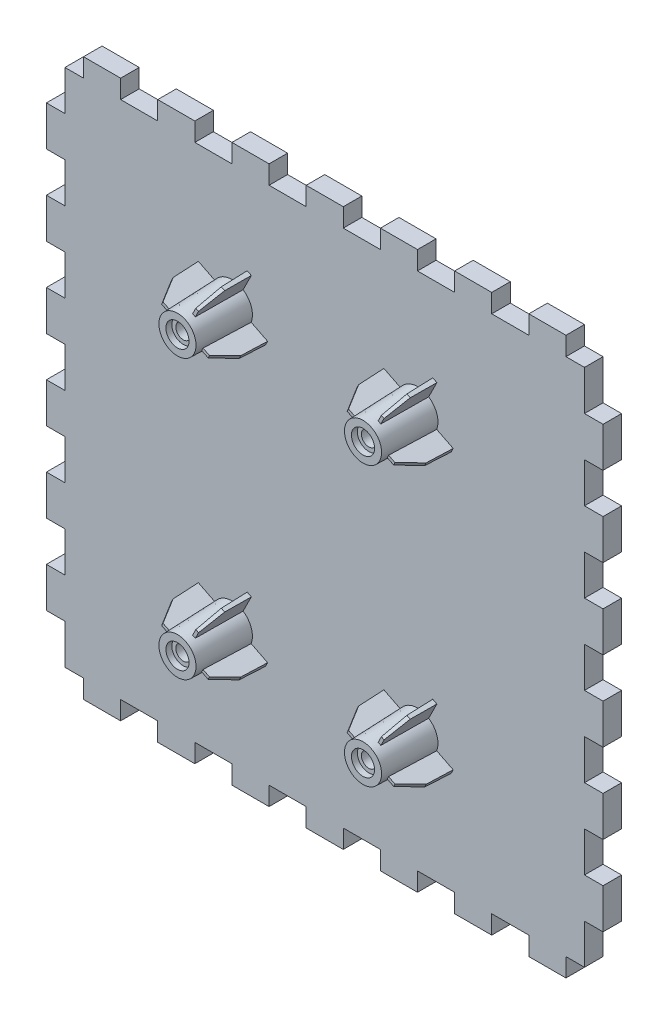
SolidWorks part; units mm, degrees
ref_plane "Front Plane" through (0, 0, 0) normal (0, 0, 1) x (1, 0, 0)
ref_plane "Top Plane" through (0, 0, 0) normal (0, 1, 0) x (1, 0, 0)
ref_plane "Right Plane" through (0, 0, 0) normal (1, 0, 0) x (0, 0, -1)
sketch "Model" plane through (0, 0, 0) normal (0, 0, 1) x (1, 0, 0)
  line L0 (83, 83) -> (87, 83)
  line L1 (87, 83) -> (87, 79)
  line L2 (87, 79) -> (95, 79)
  line L3 (95, 79) -> (95, 83)
  line L4 (95, 83) -> (103, 83)
  line L5 (103, 83) -> (103, 79)
  line L6 (103, 79) -> (111, 79)
  line L7 (111, 79) -> (111, 83)
  line L8 (111, 83) -> (119, 83)
  line L9 (119, 83) -> (119, 79)
  line L10 (119, 79) -> (127, 79)
  line L11 (127, 79) -> (127, 83)
  line L12 (127, 83) -> (135, 83)
  line L13 (135, 83) -> (135, 79)
  line L14 (135, 79) -> (143, 79)
  line L15 (143, 79) -> (143, 83)
  line L16 (143, 83) -> (151, 83)
  line L17 (151, 83) -> (151, 79)
  line L18 (151, 79) -> (159, 79)
  line L19 (159, 79) -> (159, 83)
  line L20 (159, 83) -> (167, 83)
  line L21 (167, 83) -> (167, 79)
  line L22 (167, 79) -> (175, 79)
  line L23 (175, 79) -> (175, 83)
  line L24 (175, 83) -> (183, 83)
  line L25 (183, 83) -> (183, 79)
  line L26 (183, 79) -> (191, 79)
  line L27 (191, 79) -> (191, 83)
  line L28 (191, 83) -> (195, 83)
  line L29 (195, 83) -> (195, 91.61)
  line L30 (195, 91.61) -> (199, 91.61)
  line L31 (199, 91.61) -> (199, 100.23)
  line L32 (199, 100.23) -> (195, 100.23)
  line L33 (195, 100.23) -> (195, 108.85)
  line L34 (195, 108.85) -> (199, 108.85)
  line L35 (199, 108.85) -> (199, 117.46)
  line L36 (199, 117.46) -> (195, 117.46)
  line L37 (195, 117.46) -> (195, 126.08)
  line L38 (195, 126.08) -> (199, 126.08)
  line L39 (199, 126.08) -> (199, 134.69)
  line L40 (199, 134.69) -> (195, 134.69)
  line L41 (195, 134.69) -> (195, 143.31)
  line L42 (195, 143.31) -> (199, 143.31)
  line L43 (199, 143.31) -> (199, 151.92)
  line L44 (199, 151.92) -> (195, 151.92)
  line L45 (195, 151.92) -> (195, 160.54)
  line L46 (195, 160.54) -> (199, 160.54)
  line L47 (199, 160.54) -> (199, 169.15)
  line L48 (199, 169.15) -> (195, 169.15)
  line L49 (195, 169.15) -> (195, 177.77)
  line L50 (195, 177.77) -> (199, 177.77)
  line L51 (199, 177.77) -> (199, 186.38)
  line L52 (199, 186.38) -> (195, 186.38)
  line L53 (195, 186.38) -> (195, 195)
  line L54 (195, 195) -> (191, 195)
  line L55 (191, 195) -> (191, 199)
  line L56 (191, 199) -> (183, 199)
  line L57 (183, 199) -> (183, 195)
  line L58 (183, 195) -> (175, 195)
  line L59 (175, 195) -> (175, 199)
  line L60 (175, 199) -> (167, 199)
  line L61 (167, 199) -> (167, 195)
  line L62 (167, 195) -> (159, 195)
  line L63 (159, 195) -> (159, 199)
  line L64 (159, 199) -> (151, 199)
  line L65 (151, 199) -> (151, 195)
  line L66 (151, 195) -> (143, 195)
  line L67 (143, 195) -> (143, 199)
  line L68 (143, 199) -> (135, 199)
  line L69 (135, 199) -> (135, 195)
  line L70 (135, 195) -> (127, 195)
  line L71 (127, 195) -> (127, 199)
  line L72 (127, 199) -> (119, 199)
  line L73 (119, 199) -> (119, 195)
  line L74 (119, 195) -> (111, 195)
  line L75 (111, 195) -> (111, 199)
  line L76 (111, 199) -> (103, 199)
  line L77 (103, 199) -> (103, 195)
  line L78 (103, 195) -> (95, 195)
  line L79 (95, 195) -> (95, 199)
  line L80 (95, 199) -> (87, 199)
  line L81 (87, 199) -> (87, 195)
  line L82 (87, 195) -> (83, 195)
  line L83 (83, 195) -> (83, 186.38)
  line L84 (83, 186.38) -> (79, 186.38)
  line L85 (79, 186.38) -> (79, 177.77)
  line L86 (79, 177.77) -> (83, 177.77)
  line L87 (83, 177.77) -> (83, 169.15)
  line L88 (83, 169.15) -> (79, 169.15)
  line L89 (79, 169.15) -> (79, 160.54)
  line L90 (79, 160.54) -> (83, 160.54)
  line L91 (83, 160.54) -> (83, 151.92)
  line L92 (83, 151.92) -> (79, 151.92)
  line L93 (79, 151.92) -> (79, 143.31)
  line L94 (79, 143.31) -> (83, 143.31)
  line L95 (83, 143.31) -> (83, 134.69)
  line L96 (83, 134.69) -> (79, 134.69)
  line L97 (79, 134.69) -> (79, 126.08)
  line L98 (79, 126.08) -> (83, 126.08)
  line L99 (83, 126.08) -> (83, 117.46)
  line L100 (83, 117.46) -> (79, 117.46)
  line L101 (79, 117.46) -> (79, 108.85)
  line L102 (79, 108.85) -> (83, 108.85)
  line L103 (83, 108.85) -> (83, 100.23)
  line L104 (83, 100.23) -> (79, 100.23)
  line L105 (79, 100.23) -> (79, 91.61)
  line L106 (79, 91.61) -> (83, 91.61)
  line L107 (83, 91.61) -> (83, 83)
  line L108 (83, 0) -> (91.61, 0)
  line L109 (91.61, 0) -> (91.61, 4)
  line L110 (91.61, 4) -> (100.23, 4)
  line L111 (100.23, 4) -> (100.23, 0)
  line L112 (100.23, 0) -> (108.85, 0)
  line L113 (108.85, 0) -> (108.85, 4)
  line L114 (108.85, 4) -> (117.46, 4)
  line L115 (117.46, 4) -> (117.46, 0)
  line L116 (117.46, 0) -> (126.08, 0)
  line L117 (126.08, 0) -> (126.08, 4)
  line L118 (126.08, 4) -> (134.69, 4)
  line L119 (134.69, 4) -> (134.69, 0)
  line L120 (134.69, 0) -> (143.31, 0)
  line L121 (143.31, 0) -> (143.31, 4)
  line L122 (143.31, 4) -> (151.92, 4)
  line L123 (151.92, 4) -> (151.92, 0)
  line L124 (151.92, 0) -> (160.54, 0)
  line L125 (160.54, 0) -> (160.54, 4)
  line L126 (160.54, 4) -> (169.15, 4)
  line L127 (169.15, 4) -> (169.15, 0)
  line L128 (169.15, 0) -> (177.77, 0)
  line L129 (177.77, 0) -> (177.77, 4)
  line L130 (177.77, 4) -> (186.38, 4)
  line L131 (186.38, 4) -> (186.38, 0)
  line L132 (186.38, 0) -> (195, 0)
  line L133 (195, 0) -> (199, 0)
  line L134 (199, 0) -> (199, 8.33)
  line L135 (199, 8.33) -> (195, 8.33)
  line L136 (195, 8.33) -> (195, 16.67)
  line L137 (195, 16.67) -> (199, 16.67)
  line L138 (199, 16.67) -> (199, 25)
  line L139 (199, 25) -> (195, 25)
  line L140 (195, 25) -> (195, 33.33)
  line L141 (195, 33.33) -> (199, 33.33)
  line L142 (199, 33.33) -> (199, 41.67)
  line L143 (199, 41.67) -> (195, 41.67)
  line L144 (195, 41.67) -> (195, 50)
  line L145 (195, 50) -> (199, 50)
  line L146 (199, 50) -> (199, 58.33)
  line L147 (199, 58.33) -> (195, 58.33)
  line L148 (195, 58.33) -> (195, 66.67)
  line L149 (195, 66.67) -> (199, 66.67)
  line L150 (199, 66.67) -> (199, 75)
  line L151 (199, 75) -> (191, 75)
  line L152 (191, 75) -> (191, 71)
  line L153 (191, 71) -> (183, 71)
  line L154 (183, 71) -> (183, 75)
  line L155 (183, 75) -> (175, 75)
  line L156 (175, 75) -> (175, 71)
  line L157 (175, 71) -> (167, 71)
  line L158 (167, 71) -> (167, 75)
  line L159 (167, 75) -> (159, 75)
  line L160 (159, 75) -> (159, 71)
  line L161 (159, 71) -> (151, 71)
  line L162 (151, 71) -> (151, 75)
  line L163 (151, 75) -> (143, 75)
  line L164 (143, 75) -> (143, 71)
  line L165 (143, 71) -> (135, 71)
  line L166 (135, 71) -> (135, 75)
  line L167 (135, 75) -> (127, 75)
  line L168 (127, 75) -> (127, 71)
  line L169 (127, 71) -> (119, 71)
  line L170 (119, 71) -> (119, 75)
  line L171 (119, 75) -> (111, 75)
  line L172 (111, 75) -> (111, 71)
  line L173 (111, 71) -> (103, 71)
  line L174 (103, 71) -> (103, 75)
  line L175 (103, 75) -> (95, 75)
  line L176 (95, 75) -> (95, 71)
  line L177 (95, 71) -> (87, 71)
  line L178 (87, 71) -> (87, 75)
  line L179 (87, 75) -> (79, 75)
  line L180 (79, 75) -> (79, 66.67)
  line L181 (79, 66.67) -> (83, 66.67)
  line L182 (83, 66.67) -> (83, 58.33)
  line L183 (83, 58.33) -> (79, 58.33)
  line L184 (79, 58.33) -> (79, 50)
  line L185 (79, 50) -> (83, 50)
  line L186 (83, 50) -> (83, 41.67)
  line L187 (83, 41.67) -> (79, 41.67)
  line L188 (79, 41.67) -> (79, 33.33)
  line L189 (79, 33.33) -> (83, 33.33)
  line L190 (83, 33.33) -> (83, 25)
  line L191 (83, 25) -> (79, 25)
  line L192 (79, 25) -> (79, 16.67)
  line L193 (79, 16.67) -> (83, 16.67)
  line L194 (83, 16.67) -> (83, 8.33)
  line L195 (83, 8.33) -> (79, 8.33)
  line L196 (79, 8.33) -> (79, 0)
  line L197 (79, 0) -> (83, 0)
  line L198 (83, 278) -> (91.61, 278)
  line L199 (91.61, 278) -> (91.61, 274)
  line L200 (91.61, 274) -> (100.23, 274)
  line L201 (100.23, 274) -> (100.23, 278)
  line L202 (100.23, 278) -> (108.85, 278)
  line L203 (108.85, 278) -> (108.85, 274)
  line L204 (108.85, 274) -> (117.46, 274)
  line L205 (117.46, 274) -> (117.46, 278)
  line L206 (117.46, 278) -> (126.08, 278)
  line L207 (126.08, 278) -> (126.08, 274)
  line L208 (126.08, 274) -> (134.69, 274)
  line L209 (134.69, 274) -> (134.69, 278)
  line L210 (134.69, 278) -> (143.31, 278)
  line L211 (143.31, 278) -> (143.31, 274)
  line L212 (143.31, 274) -> (151.92, 274)
  line L213 (151.92, 274) -> (151.92, 278)
  line L214 (151.92, 278) -> (160.54, 278)
  line L215 (160.54, 278) -> (160.54, 274)
  line L216 (160.54, 274) -> (169.15, 274)
  line L217 (169.15, 274) -> (169.15, 278)
  line L218 (169.15, 278) -> (177.77, 278)
  line L219 (177.77, 278) -> (177.77, 274)
  line L220 (177.77, 274) -> (186.38, 274)
  line L221 (186.38, 274) -> (186.38, 278)
  line L222 (186.38, 278) -> (195, 278)
  line L223 (195, 278) -> (199, 278)
  line L224 (199, 278) -> (199, 269.67)
  line L225 (199, 269.67) -> (195, 269.67)
  line L226 (195, 269.67) -> (195, 261.33)
  line L227 (195, 261.33) -> (199, 261.33)
  line L228 (199, 261.33) -> (199, 253)
  line L229 (199, 253) -> (195, 253)
  line L230 (195, 253) -> (195, 244.67)
  line L231 (195, 244.67) -> (199, 244.67)
  line L232 (199, 244.67) -> (199, 236.33)
  line L233 (199, 236.33) -> (195, 236.33)
  line L234 (195, 236.33) -> (195, 228)
  line L235 (195, 228) -> (199, 228)
  line L236 (199, 228) -> (199, 219.67)
  line L237 (199, 219.67) -> (195, 219.67)
  line L238 (195, 219.67) -> (195, 211.33)
  line L239 (195, 211.33) -> (199, 211.33)
  line L240 (199, 211.33) -> (199, 203)
  line L241 (199, 203) -> (191, 203)
  line L242 (191, 203) -> (191, 207)
  line L243 (191, 207) -> (183, 207)
  line L244 (183, 207) -> (183, 203)
  line L245 (183, 203) -> (175, 203)
  line L246 (175, 203) -> (175, 207)
  line L247 (175, 207) -> (167, 207)
  line L248 (167, 207) -> (167, 203)
  line L249 (167, 203) -> (159, 203)
  line L250 (159, 203) -> (159, 207)
  line L251 (159, 207) -> (151, 207)
  line L252 (151, 207) -> (151, 203)
  line L253 (151, 203) -> (143, 203)
  line L254 (143, 203) -> (143, 207)
  line L255 (143, 207) -> (135, 207)
  line L256 (135, 207) -> (135, 203)
  line L257 (135, 203) -> (127, 203)
  line L258 (127, 203) -> (127, 207)
  line L259 (127, 207) -> (119, 207)
  line L260 (119, 207) -> (119, 203)
  line L261 (119, 203) -> (111, 203)
  line L262 (111, 203) -> (111, 207)
  line L263 (111, 207) -> (103, 207)
  line L264 (103, 207) -> (103, 203)
  line L265 (103, 203) -> (95, 203)
  line L266 (95, 203) -> (95, 207)
  line L267 (95, 207) -> (87, 207)
  line L268 (87, 207) -> (87, 203)
  line L269 (87, 203) -> (79, 203)
  line L270 (79, 203) -> (79, 211.33)
  line L271 (79, 211.33) -> (83, 211.33)
  line L272 (83, 211.33) -> (83, 219.67)
  line L273 (83, 219.67) -> (79, 219.67)
  line L274 (79, 219.67) -> (79, 228)
  line L275 (79, 228) -> (83, 228)
  line L276 (83, 228) -> (83, 236.33)
  line L277 (83, 236.33) -> (79, 236.33)
  line L278 (79, 236.33) -> (79, 244.67)
  line L279 (79, 244.67) -> (83, 244.67)
  line L280 (83, 244.67) -> (83, 253)
  line L281 (83, 253) -> (79, 253)
  line L282 (79, 253) -> (79, 261.33)
  line L283 (79, 261.33) -> (83, 261.33)
  line L284 (83, 261.33) -> (83, 269.67)
  line L285 (83, 269.67) -> (79, 269.67)
  line L286 (79, 269.67) -> (79, 278)
  line L287 (79, 278) -> (83, 278)
  line L288 (0, 83) -> (0, 91.61)
  line L289 (0, 91.61) -> (4, 91.61)
  line L290 (4, 91.61) -> (4, 100.23)
  line L291 (4, 100.23) -> (0, 100.23)
  line L292 (0, 100.23) -> (0, 108.85)
  line L293 (0, 108.85) -> (4, 108.85)
  line L294 (4, 108.85) -> (4, 117.46)
  line L295 (4, 117.46) -> (0, 117.46)
  line L296 (0, 117.46) -> (0, 126.08)
  line L297 (0, 126.08) -> (4, 126.08)
  line L298 (4, 126.08) -> (4, 134.69)
  line L299 (4, 134.69) -> (0, 134.69)
  line L300 (0, 134.69) -> (0, 143.31)
  line L301 (0, 143.31) -> (4, 143.31)
  line L302 (4, 143.31) -> (4, 151.92)
  line L303 (4, 151.92) -> (0, 151.92)
  line L304 (0, 151.92) -> (0, 160.54)
  line L305 (0, 160.54) -> (4, 160.54)
  line L306 (4, 160.54) -> (4, 169.15)
  line L307 (4, 169.15) -> (0, 169.15)
  line L308 (0, 169.15) -> (0, 177.77)
  line L309 (0, 177.77) -> (4, 177.77)
  line L310 (4, 177.77) -> (4, 186.38)
  line L311 (4, 186.38) -> (0, 186.38)
  line L312 (0, 186.38) -> (0, 195)
  line L313 (0, 195) -> (8.33, 195)
  line L314 (8.33, 195) -> (8.33, 199)
  line L315 (8.33, 199) -> (16.67, 199)
  line L316 (16.67, 199) -> (16.67, 195)
  line L317 (16.67, 195) -> (25, 195)
  line L318 (25, 195) -> (25, 199)
  line L319 (25, 199) -> (33.33, 199)
  line L320 (33.33, 199) -> (33.33, 195)
  line L321 (33.33, 195) -> (41.67, 195)
  line L322 (41.67, 195) -> (41.67, 199)
  line L323 (41.67, 199) -> (50, 199)
  line L324 (50, 199) -> (50, 195)
  line L325 (50, 195) -> (58.33, 195)
  line L326 (58.33, 195) -> (58.33, 199)
  line L327 (58.33, 199) -> (66.67, 199)
  line L328 (66.67, 199) -> (66.67, 195)
  line L329 (66.67, 195) -> (75, 195)
  line L330 (75, 195) -> (75, 186.38)
  line L331 (75, 186.38) -> (71, 186.38)
  line L332 (71, 186.38) -> (71, 177.77)
  line L333 (71, 177.77) -> (75, 177.77)
  line L334 (75, 177.77) -> (75, 169.15)
  line L335 (75, 169.15) -> (71, 169.15)
  line L336 (71, 169.15) -> (71, 160.54)
  line L337 (71, 160.54) -> (75, 160.54)
  line L338 (75, 160.54) -> (75, 151.92)
  line L339 (75, 151.92) -> (71, 151.92)
  line L340 (71, 151.92) -> (71, 143.31)
  line L341 (71, 143.31) -> (75, 143.31)
  line L342 (75, 143.31) -> (75, 134.69)
  line L343 (75, 134.69) -> (71, 134.69)
  line L344 (71, 134.69) -> (71, 126.08)
  line L345 (71, 126.08) -> (75, 126.08)
  line L346 (75, 126.08) -> (75, 117.46)
  line L347 (75, 117.46) -> (71, 117.46)
  line L348 (71, 117.46) -> (71, 108.85)
  line L349 (71, 108.85) -> (75, 108.85)
  line L350 (75, 108.85) -> (75, 100.23)
  line L351 (75, 100.23) -> (71, 100.23)
  line L352 (71, 100.23) -> (71, 91.61)
  line L353 (71, 91.61) -> (75, 91.61)
  line L354 (75, 91.61) -> (75, 83)
  line L355 (75, 83) -> (66.67, 83)
  line L356 (66.67, 83) -> (66.67, 79)
  line L357 (66.67, 79) -> (58.33, 79)
  line L358 (58.33, 79) -> (58.33, 83)
  line L359 (58.33, 83) -> (50, 83)
  line L360 (50, 83) -> (50, 79)
  line L361 (50, 79) -> (41.67, 79)
  line L362 (41.67, 79) -> (41.67, 83)
  line L363 (41.67, 83) -> (33.33, 83)
  line L364 (33.33, 83) -> (33.33, 79)
  line L365 (33.33, 79) -> (25, 79)
  line L366 (25, 79) -> (25, 83)
  line L367 (25, 83) -> (16.67, 83)
  line L368 (16.67, 83) -> (16.67, 79)
  line L369 (16.67, 79) -> (8.33, 79)
  line L370 (8.33, 79) -> (8.33, 83)
  line L371 (8.33, 83) -> (0, 83)
  line L372 (278, 83) -> (278, 91.61)
  line L373 (278, 91.61) -> (274, 91.61)
  line L374 (274, 91.61) -> (274, 100.23)
  line L375 (274, 100.23) -> (278, 100.23)
  line L376 (278, 100.23) -> (278, 108.85)
  line L377 (278, 108.85) -> (274, 108.85)
  line L378 (274, 108.85) -> (274, 117.46)
  line L379 (274, 117.46) -> (278, 117.46)
  line L380 (278, 117.46) -> (278, 126.08)
  line L381 (278, 126.08) -> (274, 126.08)
  line L382 (274, 126.08) -> (274, 134.69)
  line L383 (274, 134.69) -> (278, 134.69)
  line L384 (278, 134.69) -> (278, 143.31)
  line L385 (278, 143.31) -> (274, 143.31)
  line L386 (274, 143.31) -> (274, 151.92)
  line L387 (274, 151.92) -> (278, 151.92)
  line L388 (278, 151.92) -> (278, 160.54)
  line L389 (278, 160.54) -> (274, 160.54)
  line L390 (274, 160.54) -> (274, 169.15)
  line L391 (274, 169.15) -> (278, 169.15)
  line L392 (278, 169.15) -> (278, 177.77)
  line L393 (278, 177.77) -> (274, 177.77)
  line L394 (274, 177.77) -> (274, 186.38)
  line L395 (274, 186.38) -> (278, 186.38)
  line L396 (278, 186.38) -> (278, 195)
  line L397 (278, 195) -> (269.67, 195)
  line L398 (269.67, 195) -> (269.67, 199)
  line L399 (269.67, 199) -> (261.33, 199)
  line L400 (261.33, 199) -> (261.33, 195)
  line L401 (261.33, 195) -> (253, 195)
  line L402 (253, 195) -> (253, 199)
  line L403 (253, 199) -> (244.67, 199)
  line L404 (244.67, 199) -> (244.67, 195)
  line L405 (244.67, 195) -> (236.33, 195)
  line L406 (236.33, 195) -> (236.33, 199)
  line L407 (236.33, 199) -> (228, 199)
  line L408 (228, 199) -> (228, 195)
  line L409 (228, 195) -> (219.67, 195)
  line L410 (219.67, 195) -> (219.67, 199)
  line L411 (219.67, 199) -> (211.33, 199)
  line L412 (211.33, 199) -> (211.33, 195)
  line L413 (211.33, 195) -> (203, 195)
  line L414 (203, 195) -> (203, 186.38)
  line L415 (203, 186.38) -> (207, 186.38)
  line L416 (207, 186.38) -> (207, 177.77)
  line L417 (207, 177.77) -> (203, 177.77)
  line L418 (203, 177.77) -> (203, 169.15)
  line L419 (203, 169.15) -> (207, 169.15)
  line L420 (207, 169.15) -> (207, 160.54)
  line L421 (207, 160.54) -> (203, 160.54)
  line L422 (203, 160.54) -> (203, 151.92)
  line L423 (203, 151.92) -> (207, 151.92)
  line L424 (207, 151.92) -> (207, 143.31)
  line L425 (207, 143.31) -> (203, 143.31)
  line L426 (203, 143.31) -> (203, 134.69)
  line L427 (203, 134.69) -> (207, 134.69)
  line L428 (207, 134.69) -> (207, 126.08)
  line L429 (207, 126.08) -> (203, 126.08)
  line L430 (203, 126.08) -> (203, 117.46)
  line L431 (203, 117.46) -> (207, 117.46)
  line L432 (207, 117.46) -> (207, 108.85)
  line L433 (207, 108.85) -> (203, 108.85)
  line L434 (203, 108.85) -> (203, 100.23)
  line L435 (203, 100.23) -> (207, 100.23)
  line L436 (207, 100.23) -> (207, 91.61)
  line L437 (207, 91.61) -> (203, 91.61)
  line L438 (203, 91.61) -> (203, 83)
  line L439 (203, 83) -> (211.33, 83)
  line L440 (211.33, 83) -> (211.33, 79)
  line L441 (211.33, 79) -> (219.67, 79)
  line L442 (219.67, 79) -> (219.67, 83)
  line L443 (219.67, 83) -> (228, 83)
  line L444 (228, 83) -> (228, 79)
  line L445 (228, 79) -> (236.33, 79)
  line L446 (236.33, 79) -> (236.33, 83)
  line L447 (236.33, 83) -> (244.67, 83)
  line L448 (244.67, 83) -> (244.67, 79)
  line L449 (244.67, 79) -> (253, 79)
  line L450 (253, 79) -> (253, 83)
  line L451 (253, 83) -> (261.33, 83)
  line L452 (261.33, 83) -> (261.33, 79)
  line L453 (261.33, 79) -> (269.67, 79)
  line L454 (269.67, 79) -> (269.67, 83)
  line L455 (269.67, 83) -> (278, 83)
  line L456 (83, 286) -> (91.61, 286)
  line L457 (91.61, 286) -> (91.61, 282)
  line L458 (91.61, 282) -> (100.23, 282)
  line L459 (100.23, 282) -> (100.23, 286)
  line L460 (100.23, 286) -> (108.85, 286)
  line L461 (108.85, 286) -> (108.85, 282)
  line L462 (108.85, 282) -> (117.46, 282)
  line L463 (117.46, 282) -> (117.46, 286)
  line L464 (117.46, 286) -> (126.08, 286)
  line L465 (126.08, 286) -> (126.08, 282)
  line L466 (126.08, 282) -> (134.69, 282)
  line L467 (134.69, 282) -> (134.69, 286)
  line L468 (134.69, 286) -> (143.31, 286)
  line L469 (143.31, 286) -> (143.31, 282)
  line L470 (143.31, 282) -> (151.92, 282)
  line L471 (151.92, 282) -> (151.92, 286)
  line L472 (151.92, 286) -> (160.54, 286)
  line L473 (160.54, 286) -> (160.54, 282)
  line L474 (160.54, 282) -> (169.15, 282)
  line L475 (169.15, 282) -> (169.15, 286)
  line L476 (169.15, 286) -> (177.77, 286)
  line L477 (177.77, 286) -> (177.77, 282)
  line L478 (177.77, 282) -> (186.38, 282)
  line L479 (186.38, 282) -> (186.38, 286)
  line L480 (186.38, 286) -> (195, 286)
  line L481 (195, 286) -> (195, 294.62)
  line L482 (195, 294.62) -> (199, 294.62)
  line L483 (199, 294.62) -> (199, 303.23)
  line L484 (199, 303.23) -> (195, 303.23)
  line L485 (195, 303.23) -> (195, 311.85)
  line L486 (195, 311.85) -> (199, 311.85)
  line L487 (199, 311.85) -> (199, 320.46)
  line L488 (199, 320.46) -> (195, 320.46)
  line L489 (195, 320.46) -> (195, 329.08)
  line L490 (195, 329.08) -> (199, 329.08)
  line L491 (199, 329.08) -> (199, 337.69)
  line L492 (199, 337.69) -> (195, 337.69)
  line L493 (195, 337.69) -> (195, 346.31)
  line L494 (195, 346.31) -> (199, 346.31)
  line L495 (199, 346.31) -> (199, 354.92)
  line L496 (199, 354.92) -> (195, 354.92)
  line L497 (195, 354.92) -> (195, 363.54)
  line L498 (195, 363.54) -> (199, 363.54)
  line L499 (199, 363.54) -> (199, 372.15)
  line L500 (199, 372.15) -> (195, 372.15)
  line L501 (195, 372.15) -> (195, 380.77)
  line L502 (195, 380.77) -> (199, 380.77)
  line L503 (199, 380.77) -> (199, 389.38)
  line L504 (199, 389.38) -> (195, 389.38)
  line L505 (195, 389.38) -> (195, 398)
  line L506 (195, 398) -> (186.38, 398)
  line L507 (186.38, 398) -> (186.38, 402)
  line L508 (186.38, 402) -> (177.77, 402)
  line L509 (177.77, 402) -> (177.77, 398)
  line L510 (177.77, 398) -> (169.15, 398)
  line L511 (169.15, 398) -> (169.15, 402)
  line L512 (169.15, 402) -> (160.54, 402)
  line L513 (160.54, 402) -> (160.54, 398)
  line L514 (160.54, 398) -> (151.92, 398)
  line L515 (151.92, 398) -> (151.92, 402)
  line L516 (151.92, 402) -> (143.31, 402)
  line L517 (143.31, 402) -> (143.31, 398)
  line L518 (143.31, 398) -> (134.69, 398)
  line L519 (134.69, 398) -> (134.69, 402)
  line L520 (134.69, 402) -> (126.08, 402)
  line L521 (126.08, 402) -> (126.08, 398)
  line L522 (126.08, 398) -> (117.46, 398)
  line L523 (117.46, 398) -> (117.46, 402)
  line L524 (117.46, 402) -> (108.85, 402)
  line L525 (108.85, 402) -> (108.85, 398)
  line L526 (108.85, 398) -> (100.23, 398)
  line L527 (100.23, 398) -> (100.23, 402)
  line L528 (100.23, 402) -> (91.61, 402)
  line L529 (91.61, 402) -> (91.61, 398)
  line L530 (91.61, 398) -> (83, 398)
  line L531 (83, 398) -> (83, 389.38)
  line L532 (83, 389.38) -> (79, 389.38)
  line L533 (79, 389.38) -> (79, 380.77)
  line L534 (79, 380.77) -> (83, 380.77)
  line L535 (83, 380.77) -> (83, 372.15)
  line L536 (83, 372.15) -> (79, 372.15)
  line L537 (79, 372.15) -> (79, 363.54)
  line L538 (79, 363.54) -> (83, 363.54)
  line L539 (83, 363.54) -> (83, 354.92)
  line L540 (83, 354.92) -> (79, 354.92)
  line L541 (79, 354.92) -> (79, 346.31)
  line L542 (79, 346.31) -> (83, 346.31)
  line L543 (83, 346.31) -> (83, 337.69)
  line L544 (83, 337.69) -> (79, 337.69)
  line L545 (79, 337.69) -> (79, 329.08)
  line L546 (79, 329.08) -> (83, 329.08)
  line L547 (83, 329.08) -> (83, 320.46)
  line L548 (83, 320.46) -> (79, 320.46)
  line L549 (79, 320.46) -> (79, 311.85)
  line L550 (79, 311.85) -> (83, 311.85)
  line L551 (83, 311.85) -> (83, 303.23)
  line L552 (83, 303.23) -> (79, 303.23)
  line L553 (79, 303.23) -> (79, 294.62)
  line L554 (79, 294.62) -> (83, 294.62)
  line L555 (83, 294.62) -> (83, 286)
extrude "Boss-Extrude1" add sketch "Model" along normal blind 4 contours L106 L107 L0 L1 L2 L3 L4 L5 L6 L7 L8 L9 L10 L11 L12 L13 L14 L15 L16 L17 L18 L19 L20 L21 L22 L23 L24 L25 L26 L27 L28 L29 L30 L31 L32 L33 L34 L35 L36 L37 L38 L39 L40 L41 L42 L43 L44 L45 L46 L47 L48
sketch3d "3DSketch1"
  line L0 (79, 117.46, 4) -> (79, 108.85, 4) construction
  line L1 (119, 79, 4) -> (127, 79, 4) construction
  point P0 (119, 109, 4)
  dimension "D1" = 40
  dimension "D2" = 30
other "Mounting Boss1" parameters "BossHeight"=12, "BossDiam"=8, "StepHeight"=1.5, "StepDia"=5, "HoleDiam"=3.2, "CBoreDiam"=0, "CBoreDepth"=0, "HoleDepth"=5, "D9"=0, "D10"=0, "Clearance"=0.254, "FinLength"=8, "FinWidth"=1, "FinHeight"=10, "ChamferDist"=2.4, "BossDraft"=2, "HoleDraft"=1, "StepDraft"=1.5, "D19"=0, "FinDraft"=1, "ChamferAngle"=60
pattern_linear "LPattern1" count 2 spacing 40 along (1, 0, 0) count 2 spacing 60 along (0, 1, 0) of "Mounting Boss1"
